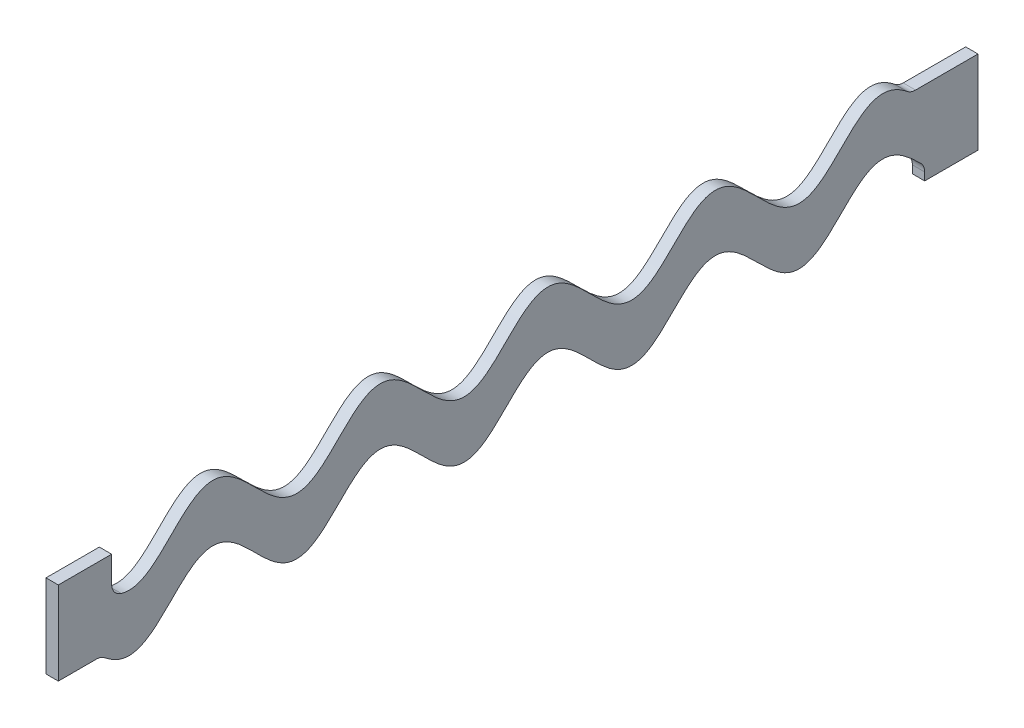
SolidWorks part; units mm, degrees
ref_plane "Front Plane" through (0, 0, 0) normal (0, 0, 1) x (1, 0, 0)
ref_plane "Top Plane" through (0, 0, 0) normal (0, 1, 0) x (1, 0, 0)
ref_plane "Right Plane" through (0, 0, 0) normal (1, 0, 0) x (0, 0, -1)
sketch "Sketch1" plane through (0, 0, 0) normal (0, 0, 1) x (1, 0, 0)
  line L0 (0, 130.175) -> (0, 25.4) construction
  line L1 (0, 38.1) -> (-11.74, 38.1)
  line L2 (0, 38.1) -> (0, 117.475)
  line L3 (0, 117.475) -> (-11.74, 117.475)
  line L4 (-11.74, 38.1) -> (-11.74, 117.475)
  line L5 (0, 25.4) -> (0, 130.175) construction
  line L6 (-127, 25.4) -> (0, 25.4) construction
  point P6 (0, 77.7875)
  point P7 (-11.74, 77.7875)
  dimension "D1" = 11.74
  dimension "D2" = 12.7
extrude "Boss-Extrude1" add sketch "Sketch1" along normal blind 50.8
sketch "Sketch2" plane through (-11.74, 0, 0) normal (-1, 0, 0) x (0, 0, 1)
  line L0 (-19.05, 130.175) -> (895.35, 130.175) construction
  line L1 (895.35, 25.4) -> (-19.05, 25.4) construction
  line L2 (-19.05, 130.175) -> (895.35, 130.175) construction
  line L3 (895.35, 25.4) -> (-19.05, 25.4) construction
sketch "Sketch4" plane through (-11.74, 0, 0) normal (-1, 0, 0) x (0, 0, 1)
  line L0 (-19.05, 130.175) -> (895.35, 130.175) construction
  line L4 (0, 117.475) -> (0, 38.1)
  line L5 (0, 38.1) -> (50.8, 38.1)
  line L6 (50.8, 38.1) -> (50.8, 117.475)
  line L7 (50.8, 117.475) -> (0, 117.475)
  line L8 (0, 117.475) -> (0, 38.1) construction
  line L9 (0, 38.1) -> (50.8, 38.1) construction
  line L10 (50.8, 38.1) -> (50.8, 117.475) construction
  line L11 (50.8, 117.475) -> (0, 117.475) construction
  line L12 (895.35, 25.4) -> (-19.05, 25.4) construction
  spline S0 degree 4 number of poles 197 (43.9271, 44.0097) -> (938.8548, 40.7853) construction
  spline S1 degree 4 number of poles 186 (50.8, 50.7997) -> (928.561, 50.7997)
  spline S2 degree 4 number of poles 197 (43.9271, 97.9852) -> (938.8548, 94.7607) construction
  spline S3 degree 4 number of poles 186 (50.8, 104.7751) -> (928.561, 104.7751)
  dimension "D1" = 0
sketch "Sketch5" plane through (-11.74, 0, 0) normal (-1, 0, 0) x (0, 0, 1)
  line L0 (876.3, 25.4) -> (876.3, 130.175) construction
  line L1 (876.3, 117.475) -> (825.5, 117.475)
  line L2 (876.3, 117.475) -> (876.3, 38.1)
  line L3 (876.3, 38.1) -> (835.4656, 38.1)
  line L4 (0, 117.475) -> (0, 38.1)
  line L5 (0, 38.1) -> (50.8, 38.1)
  line L6 (50.8, 38.1) -> (50.8, 117.475)
  line L7 (50.8, 117.475) -> (0, 117.475)
  line L8 (0, 117.475) -> (0, 38.1)
  line L9 (0, 38.1) -> (50.8, 38.1)
  line L10 (50.8, 38.1) -> (50.8, 50.7997)
  line L11 (50.8, 117.475) -> (0, 117.475)
  line L12 (825.5, 117.475) -> (825.5, 84.6296)
  line L13 (50.8, 104.7751) -> (50.8, 117.475)
  spline S0 degree 4 number of poles 186 (50.8, 50.7997) -> (928.561, 50.7997) construction
  spline S1 degree 4 number of poles 186 (50.8, 104.7751) -> (928.561, 104.7751) construction
  spline S2 degree 4 number of poles 160 (50.8, 50.7997) -> (835.4656, 38.1)
  spline S3 degree 4 number of poles 158 (50.8, 104.7751) -> (825.5, 84.6296)
  dimension "D1" = 0
extrude "Boss-Extrude2" add sketch "Sketch5" against normal up to surface (11.74 mm away)
sketch "Sketch6" plane through (0, 0, 50.8) normal (0, 0, 1) x (1, 0, 0)
  line L4 (-11.74, 104.7751) -> (0, 104.7751)
  line L5 (0, 104.7751) -> (0, 117.475)
  line L6 (0, 117.475) -> (-11.74, 117.475)
  line L7 (-11.74, 117.475) -> (-11.74, 104.7751)
  line L8 (-11.74, 104.7751) -> (0, 104.7751)
  line L9 (0, 104.7751) -> (0, 117.475)
  line L10 (0, 117.475) -> (-11.74, 117.475)
  line L11 (-11.74, 117.475) -> (-11.74, 104.7751)
  dimension "D1" = 0
extrude "Boss-Extrude3" add sketch "Sketch6" along normal up to surface (13.2992 mm away)
fillet "Fillet2" radius 12.7 4 edges at (-5.87, 84.6296, 825.5) (-5.87, 38.1, 835.4656) (-5.87, 50.7997, 50.8)
